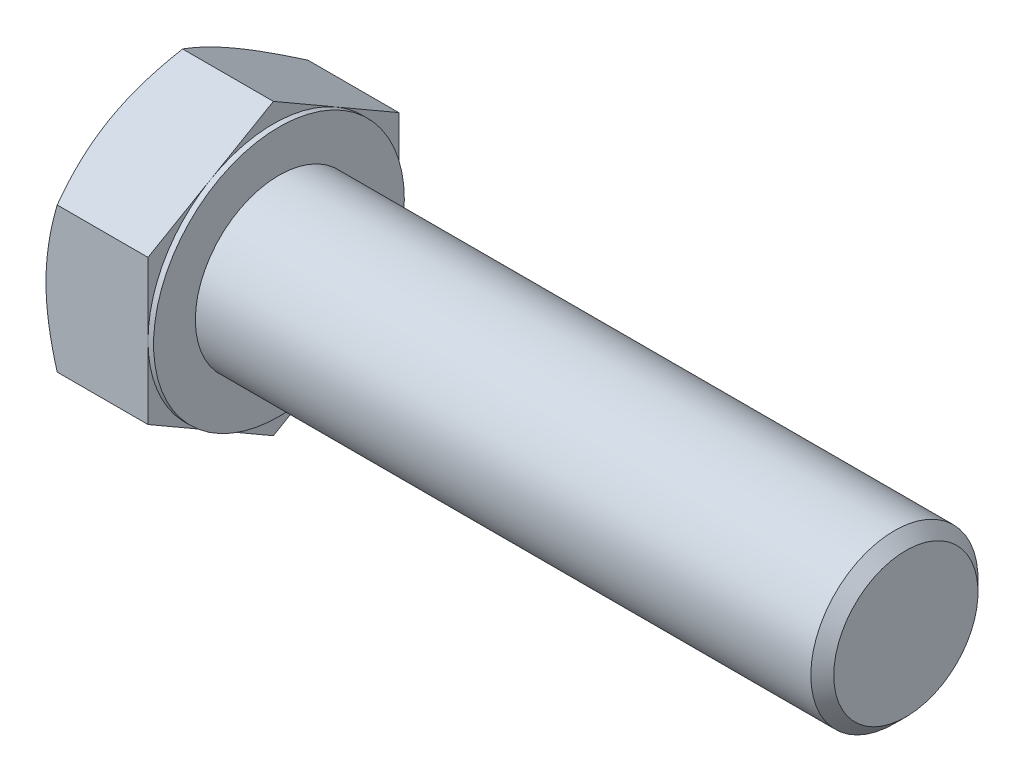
SolidWorks part; units mm, degrees
ref_plane "Plane1" through (0, 0, 0) normal (0, 0, 1) x (1, 0, 0)
ref_plane "Plane2" through (0, 0, 0) normal (0, 1, 0) x (1, 0, 0)
ref_plane "Plane3" through (0, 0, 0) normal (1, 0, 0) x (0, 0, -1)
sketch "Sketch1" plane through (0, 0, 0) normal (1, 0, 0) x (0, 0, -1)
  line L0 (18, 10.3923) -> (18, -10.3923)
  line L1 (-18, 10.3923) -> (-18, -10.3923)
  line L2 (18, -10.3923) -> (0, -20.7846)
  line L3 (0, -20.7846) -> (-18, -10.3923)
  line L4 (18, 10.3923) -> (0, 20.7846)
  line L5 (0, 20.7846) -> (-18, 10.3923)
  dimension "Width_flats" = 36
  dimension "D2" = 120
  dimension "D3" = 18
  dimension "D4" = 18
  dimension "D5" = 18
extrude "BaseHead" add sketch "Sketch1" along normal blind 15.44
sketch "BodySke" plane through (0, 0, 0) normal (0, 0, 1) x (1, 0, 0)
  line L0 (0, 10.3923) -> (0, -10.3923) construction
  line L1 (0, 0) -> (105.44, 0)
  line L2 (0, 0) -> (0, 12)
  line L3 (0, 12) -> (103.792, 12)
  line L4 (105.44, 0) -> (105.44, 10.352)
  line L5 (15.44, 20.7846) -> (15.44, 10.3923) construction
  line L6 (105.44, 10.352) -> (103.792, 12)
  line L7 (0, 0) -> (96.52, 0) construction
  line L8 (105.44, -10.352) -> (103.792, -12) construction
  line L9 (0, -12) -> (103.792, -12) construction
  line L10 (18.44, 15.24) -> (18.44, -1.27) construction
  line L11 (15.44, 15.24) -> (15.44, -1.27) construction
  line L12 (15.44, 10.3923) -> (15.44, -10.3923) construction
  dimension "Length" = 90
  dimension "Body_ch_ang" = 45
  dimension "Diameter" = 24
  dimension "Minor_dia" = 20.704
  dimension "Advance" = 3
  dimension "Thread_nom" = 90
revolve "BaseBody" add sketch "BodySke"
fillet "HeadFillet" [suppressed] radius 0.8
sketch "Sketch6"
  circle A0 centre (0.0332, 0.1924) radius 15.75
  dimension "D1" = 31.5
revolve "HeadChamfer" cut sketch "Sketch3" angle 360 about L6
sketch "Sketch3" plane through (0, 0, 0) normal (0, 0, 1) x (1, 0, 0)
  line L0 (0, 18) -> (4.4944, 25.7846)
  line L1 (0, 20.7846) -> (0, 10.3923) construction
  line L2 (4.4944, 25.7846) -> (4.4944, 30.7846)
  line L3 (4.4944, 30.7846) -> (-10, 30.7846)
  line L4 (-10, 30.7846) -> (-10, 18)
  line L5 (-10, 18) -> (0, 18)
  line L6 (0, 0) -> (99.06, 0) construction
  line L7 (15.44, 20.7846) -> (0, 20.7846) construction
  dimension "D1" = 18
  dimension "D2" = 5
  dimension "D3" = 10
  dimension "D4" = 5
  dimension "Head_ch_ang" = 30
extrude "Indent" cut sketch "Sketch6" against normal blind 1.93
sketch "Sketch5" plane through (0, 0, 0) normal (0, 0, 1) x (1, 0, 0)
  line L0 (15.44, 18) -> (10.9456, 25.7846)
  line L1 (15.44, 20.7846) -> (15.44, 10.3923) construction
  line L2 (10.9456, 25.7846) -> (10.9456, 30.7846)
  line L3 (10.9456, 30.7846) -> (20.9456, 30.7846)
  line L4 (20.9456, 30.7846) -> (20.9456, 18)
  line L5 (20.9456, 18) -> (15.44, 18)
  line L7 (15.44, 20.7846) -> (1.6077, 20.7846) construction
  line L8 (0, 0) -> (99.06, 0) construction
  line L9 (0, 0) -> (99.06, 0) construction
  dimension "D1" = 18
  dimension "D2" = 5
  dimension "D3" = 10
  dimension "Head_ch_ang" = 30
  dimension "D4" = 5
revolve "UnderHeadChamfer" [suppressed] cut sketch "Sketch5" angle 360 about L8
sketch "Sketch4" plane through (0, 0, 0) normal (0, 0, 1) x (1, 0, 0)
  line L1 (15.44, 20.7846) -> (15.44, 10.3923) construction
  line L2 (15.44, 18) -> (14.64, 18)
  line L3 (15.44, 18) -> (15.44, 30.7846)
  line L4 (15.44, 30.7846) -> (14.64, 30.7846)
  line L5 (0, 0) -> (95.25, 0) construction
  line L6 (0, 0) -> (96.52, 0) construction
  line L7 (14.64, 18) -> (14.64, 30.7846)
  line L8 (15.44, 20.7846) -> (1.6077, 20.7846) construction
  dimension "D1" = 36
  dimension "D2" = 10
  dimension "Bearing_ht" = 0.8
revolve "BearingFace" cut sketch "Sketch4" angle 360 about L5
sketch "ThdSchSke" plane through (0, 0, 0) normal (0, 0, 1) x (1, 0, 0)
  line L0 (18.44, -10.352) -> (17.2861, -12)
  line L1 (18.44, -10.352) -> (19.5939, -12)
  line L2 (19.5939, -12) -> (19.5939, -15)
  line L3 (-3.175, 0) -> (5.1513, 0) construction
  line L5 (19.5939, -15) -> (17.2861, -15)
  line L6 (17.2861, -15) -> (17.2861, -12)
  dimension "Thread_minor" = 20.704
  dimension "Diameter" = 24
  dimension "Start" = 18.44
  dimension "SideAngle" = 55
  dimension "VeeAngle" = 70
  dimension "Overcut" = 30
revolve "ThreadSchematic" [suppressed] cut sketch "ThdSchSke" angle 360 about L3
pattern_linear "ThdSchPat" [suppressed]
equation "\"D3@Sketch1\" = \"Width_flats@Sketch1\" / 2"
equation "\"D4@Sketch1\" = \"D3@Sketch1\""
equation "\"D5@Sketch1\" = \"D4@Sketch1\""
equation "\"Thread_minor@ThreadCosmetic\" = \"Minor_dia@BodySke\""
equation "\"D1@Sketch3\" = \"Width_flats@Sketch1\" / 2"
equation "\"D1@Sketch5\" = \"Width_flats@Sketch1\" / 2"
equation "\"Head_ch_ang@Sketch5\" = \"Head_ch_ang@Sketch3\""
equation "\"D1@Sketch4\" = \"Width_flats@Sketch1\""
equation "\"D1@Sketch6\" = \"Width_flats@Sketch1\" * 7/8"
equation "\"D1@Indent\" = \"Head_ht@BaseHead\" / 8"
equation "\"Thread_length@ThreadCosmetic\" = ((sgn( (\"Length@BodySke\" - \"Advance@BodySke\" ) - \"Thread_nom@BodySke\" )-1)*( (\"Length@BodySke\" - \"Advance@BodySke\" ) - \"Thread_nom@BodySke\" ))/-2+ \"Thread_nom@BodySke\""
equation "\"Thread_minor@ThdSchSke\" = \"Minor_dia@BodySke\""
equation "\"Diameter@ThdSchSke\" = \"Diameter@BodySke\""
equation "\"Overcut@ThdSchSke\" = \"Diameter@BodySke\" * 1.25"
equation "\"Start@ThdSchSke\" = \"Head_ht@BaseHead\" + \"Length@BodySke\" - \"Thread_length@ThreadCosmetic\"  '---Non-countersunk---"
equation "\"Num_threads@ThdSchPat\" = int( \"Thread_length@ThreadCosmetic\" / \"Advance@BodySke\" + 0.999 )  + 1"
equation "\"Advance@ThdSchPat\" = \"Thread_length@ThreadCosmetic\" /  (\"Num_threads@ThdSchPat\" - 1) 'relax it"
equation "\"Num_threads@ThdSchPat\" = \"Num_threads@ThdSchPat\" - sgn( \"Num_threads@ThdSchPat\" - 1) '---chamfered tips only---"
